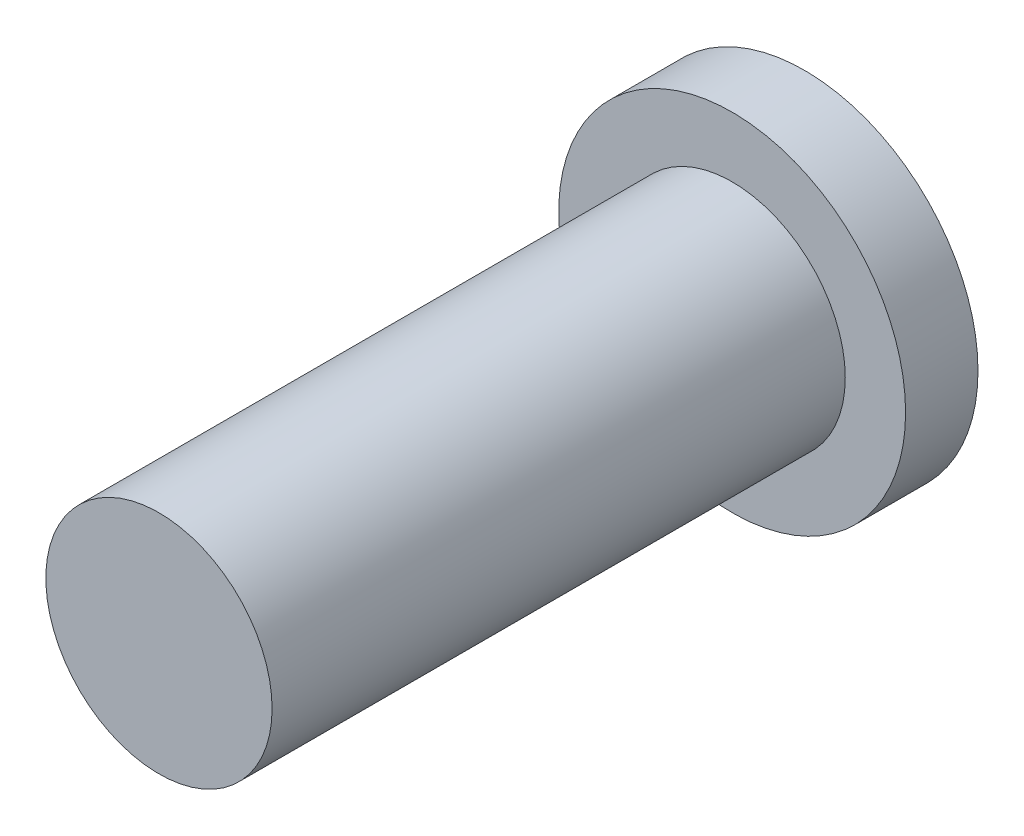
SolidWorks part; units mm, degrees
ref_plane "Plane1" through (0, 0, 0) normal (0, 0, 1) x (1, 0, 0)
ref_plane "Plane2" through (0, 0, 0) normal (0, 1, 0) x (1, 0, 0)
ref_plane "Plane3" through (0, 0, 0) normal (1, 0, 0) x (0, 0, -1)
sketch "Sketch1" plane through (0, 0, 0) normal (0, 0, 1) x (1, 0, 0)
  circle A0 centre (0, 0) radius 1.4605
  dimension "D1" = 2.921
extrude "Base-Extrude" add sketch "Sketch1" along normal blind 0.6096
sketch "Sketch2" plane through (0, 0, 0.6096) normal (0, 0, 1) x (1, 0, 0)
  circle A0 centre (0, 0) radius 0.9525
  dimension "D1" = 1.905
extrude "Boss-Extrude1" add sketch "Sketch2" along normal blind 4.826
sketch "Sketch3" plane through (0, 0, 0) normal (0, 0, -1) x (-1, 0, 0)
  line L0 (0.1905, -0.1905) -> (0.5715, -0.1905)
  line L1 (-0.5715, 0.1905) -> (-0.1905, 0.1905)
  line L2 (-0.5715, 0.1905) -> (-0.5715, -0.1905)
  line L3 (-0.5715, -0.1905) -> (-0.1905, -0.1905)
  line L4 (0.5715, 0.1905) -> (0.5715, -0.1905)
  line L5 (-0.1905, 0.5715) -> (0.1905, 0.5715)
  line L6 (-0.1905, 0.5715) -> (-0.1905, 0.1905)
  line L7 (-0.1905, -0.5715) -> (0.1905, -0.5715)
  line L8 (0.1905, 0.5715) -> (0.1905, 0.1905)
  line L9 (-0.1905, -0.1905) -> (-0.1905, -0.5715)
  line L10 (0.1905, -0.1905) -> (0.1905, -0.5715)
  line L11 (0.1905, 0.1905) -> (0.5715, 0.1905)
  dimension "D1" = 1.143
  dimension "D2" = 1.143
  dimension "D3" = 0.5715
  dimension "D4" = 0.5715
  dimension "D5" = 0.381
  dimension "D6" = 0.381
  dimension "D7" = 0.1905
  dimension "D8" = 0.1905
extrude "Cut-Extrude1" cut sketch "Sketch3" against normal blind 0.381
